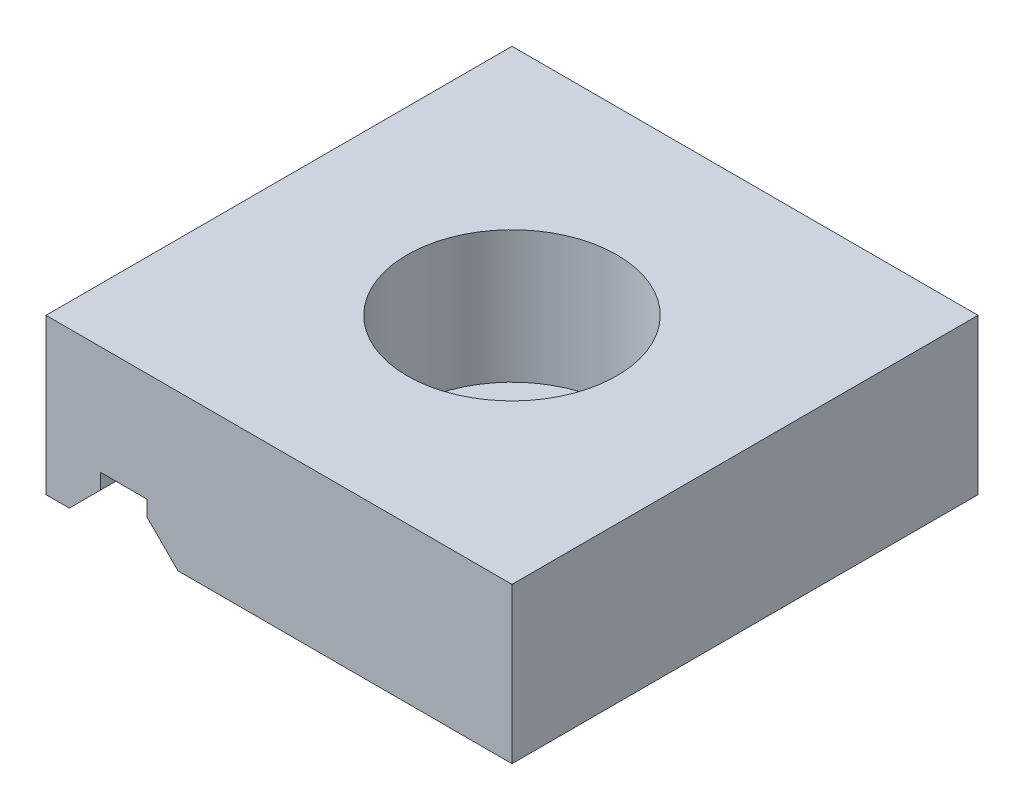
SolidWorks part; units mm, degrees
ref_plane "Vorne" through (0, 0, 0) normal (0, 0, 1) x (1, 0, 0)
ref_plane "Oben" through (0, 0, 0) normal (0, 1, 0) x (1, 0, 0)
ref_plane "Rechts" through (0, 0, 0) normal (1, 0, 0) x (0, 0, -1)
sketch "Skizze1" plane through (0, 0, 0) normal (0, 1, 0) x (1, 0, 0)
  line L1 (-15, -15) -> (15, -15)
  line L2 (-15, -15) -> (-15, 15)
  line L3 (-15, 15) -> (15, 15)
  line L4 (15, -15) -> (15, 15)
  line L5 (-15, -15) -> (15, 15) construction
  line L6 (-15, 15) -> (15, -15) construction
  point P0 (0, 0)
  dimension "D1" = 30
  dimension "D2" = 30
extrude "Aufsatz-Linear austragen1" add sketch "Skizze1" along normal blind 10
sketch "Skizze2" plane through (0, 0, 0) normal (0, -1, 0) x (1, 0, 0)
  circle A0 centre (0, 0) radius 7.4772
  dimension "D1" = 14.9545
extrude "Aufsatz-Linear austragen2" add sketch "Skizze2" along normal blind 3
hole_wizard "Stirnsenkung für M8 Zylinderschraube mit Innensechskant1" positions "Skizze4" profile "Skizze3" counterbore size "M8" standard "DIN"
sketch "Skizze4" plane through (0, 10, 0) normal (0, 1, 0) x (-1, 0, 0)
  point P0 (0, 0)
sketch "Skizze3" plane through (0, 10, 0) normal (1, 0, 0) x (0, 0, 1)
  line L0 (0, 0) -> (0, 13)
  line L1 (0, 13) -> (4.25, 13)
  line L3 (4.25, 13) -> (4.25, 8.5)
  line L4 (4.25, 8.5) -> (6.75, 8.5)
  line L5 (6.75, 8.5) -> (6.75, 0)
  line L7 (6.75, 0) -> (0, 0)
  line L11 (0, -6.35) -> (0, 107.95) construction
  dimension "Bohrerdurchmesser" = 8.5
  dimension "Bohrungstiefe" = 13
  dimension "Senkdurchmesser2" = 13.5
  dimension "Senktiefe2" = 8.5
sketch "Skizze5" plane through (0, 0, 0) normal (0, 0, 1) x (1, 0, 0)
  line L0 (0, 0) -> (0, 10) construction
  line L1 (-15, 10) -> (15, 10) construction
  line L2 (-10, -3.4449) -> (-10, 10) construction
  line L3 (-6.5, 0) -> (-5.0228, 0)
  line L4 (-13.5, 0) -> (-13.5, -3)
  line L5 (-6.5, 0) -> (-8.5, 2)
  line L6 (-8.5, 2) -> (-8.5, 3)
  line L7 (-8.5, 3) -> (-11.5, 3)
  line L8 (-5.0228, -3) -> (-13.5, -3)
  line L9 (-11.5, 2) -> (-11.5, 3)
  line L10 (-13.5, 0) -> (-11.5, 2)
  line L11 (7.4772, -3) -> (7.4772, 0) construction
  line L13 (-15, 0) -> (15, 0) construction
  line L14 (-5.0228, 0) -> (-5.0228, -3)
  line L15 (-7.4772, -3) -> (7.4772, -3) construction
  point P16 (-10, -3)
  point P17 (-10, 3)
  dimension "D1" = 10
  dimension "D2" = 90
  dimension "D3" = 3
  dimension "D4" = 1
  dimension "D5" = 3
  dimension "D6" = 12.5
extrude "Schnitt-Linear austragen1" cut sketch "Skizze5" against normal through all and the other way through all
sketch "Skizze6" [suppressed] plane through (0, 0, 0) normal (0, 0, 1) x (1, 0, 0)
  line L0 (0, 0) -> (0, 11.5) construction
  line L1 (-15, 0) -> (15, 0) construction
  line L2 (-15, 11.5) -> (15, 11.5) construction
  line L3 (-10, 11.5) -> (-10, 0) construction
  line L4 (-6.5, 11.5) -> (-13.5, 11.5)
  line L5 (-13.5, 11.5) -> (-11.5, 9.5)
  line L6 (-11.5, 9.5) -> (-11.5, 8.5)
  line L7 (-11.5, 8.5) -> (-8.5, 8.5)
  line L8 (-8.5, 9.5) -> (-8.5, 8.5)
  line L9 (-6.5, 11.5) -> (-8.5, 9.5)
  point P13 (-10, 8.5)
  dimension "D1" = 10
  dimension "D2" = 3
  dimension "D3" = 1
  dimension "D4" = 3
  dimension "D5" = 90
extrude "Schnitt-Linear austragen2" [suppressed] cut sketch "Skizze6" against normal through all and the other way through all
